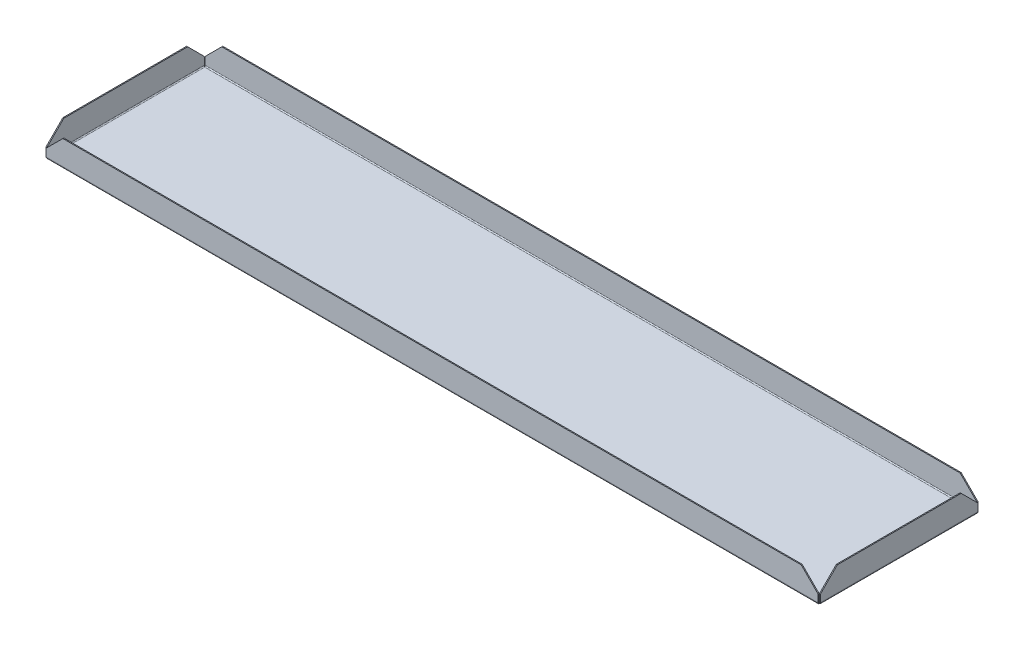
SolidWorks part; units mm, degrees
ref_plane "Front Plane" through (0, 0, 0) normal (0, 0, 1) x (1, 0, 0)
ref_plane "Top Plane" through (0, 0, 0) normal (0, 1, 0) x (1, 0, 0)
ref_plane "Right Plane" through (0, 0, 0) normal (1, 0, 0) x (0, 0, -1)
sketch "Sketch1" plane through (0, 0, 0) normal (0, 1, 0) x (1, 0, 0)
  line L1 (292.1, -60.325) -> (-292.1, -60.325)
  line L2 (292.1, -60.325) -> (292.1, 60.325)
  line L3 (292.1, 60.325) -> (-292.1, 60.325)
  line L4 (-292.1, -60.325) -> (-292.1, 60.325)
  line L5 (292.1, -60.325) -> (-292.1, 60.325) construction
  line L6 (292.1, 60.325) -> (-292.1, -60.325) construction
  point P0 (0, 0)
  dimension "D1" = 584.2
  dimension "D2" = 120.65
sheet metal parameters "Sheet-Metal1" thickness 0.7366 parameters "D1"=0.7366
base flange "Base-Flange1" sketch "Sketch1" thickness 0.7366 reverse thickness direction yes parameters "D1"=0.7366
ref_plane "Plane1" through (-292.1, 0.7366, 60.325) normal (1, 0, 0) x (0, 0, -1)
sketch "Sketch4" plane through (-292.1, 0.7366, 60.325) normal (1, 0, 0) x (0, 0, -1)
  line L0 (0, 0) -> (0, 19.05)
  dimension "D1" = 19.05
miter flange "Miter Flange1" parameters "D1"=0.7366
bend "Miterbend1" bend radius 0.7366 bend angle 90 parameters "D5"=1
bend "Miterbend2" bend radius 0.7366 bend angle 90 parameters "D5"=2
bend "Miterbend3" bend radius 0.7366 bend angle 90 parameters "D5"=3
bend "Miterbend4" bend radius 0.7366 bend angle 90 parameters "D5"=4
break corner "Break-Corner1" thickness 0.7366 parameters "D1"=12.7, "D7"=5
flat pattern "Flat-Pattern1"
sketch "Bend-Lines1" plane through (0, 0.7366, 0) normal (0, 1, 0) x (-1, 0, 0)
  line L0 (291.4946, 59.4088) -> (291.4946, -59.4088) construction
  line L1 (291.1838, -59.7196) -> (-291.1838, -59.7196) construction
  line L2 (-291.4946, -59.4088) -> (-291.4946, 59.4088) construction
  line L3 (-291.1838, 59.7196) -> (291.1838, 59.7196) construction
  line L4 (291.4946, 59.4088) -> (291.4946, -59.4088) construction
  line L5 (291.1838, -59.7196) -> (-291.1838, -59.7196) construction
  line L6 (-291.4946, -59.4088) -> (-291.4946, 59.4088) construction
  line L7 (-291.1838, 59.7196) -> (291.1838, 59.7196) construction
sketch3d "Bounding-Box1" [suppressed]
  line L0 (-602.7758, 139.2258, 0) -> (18.5758, 139.2258, 0) construction
  line L1 (-602.7758, -18.5758, 0) -> (18.5758, -18.5758, 0) construction
  line L2 (-602.7758, 139.2258, 0) -> (-602.7758, -18.5758, 0) construction
  line L3 (18.5758, 139.2258, 0) -> (18.5758, -18.5758, 0) construction
bend of the flat pattern "Flatten-<Miterbend1>1"
bend of the flat pattern "Flatten-<Miterbend2>1"
bend of the flat pattern "Flatten-<Miterbend3>1"
bend of the flat pattern "Flatten-<Miterbend4>1"
